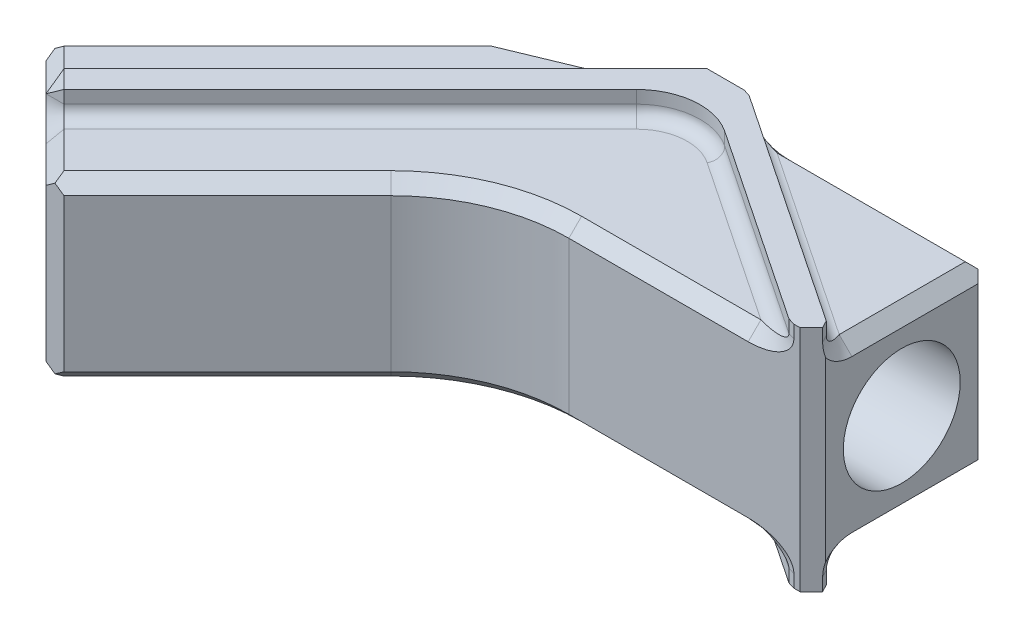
SolidWorks part; units mm, degrees
ref_plane "Front Plane" through (0, 0, 0) normal (0, 0, 1) x (1, 0, 0)
ref_plane "Top Plane" through (0, 0, 0) normal (0, 1, 0) x (1, 0, 0)
ref_plane "Right Plane" through (0, 0, 0) normal (1, 0, 0) x (0, 0, -1)
sketch "Sketch1" plane through (0, 0, 0) normal (0, 1, 0) x (1, 0, 0)
  line L0 (0, 0) -> (-9.8995, 9.8995)
  line L1 (0, 0) -> (25, 0)
  line L2 (0, 0) -> (0, 14)
  line L3 (0, 14) -> (25, 14)
  line L4 (25, 0) -> (25, 14)
  line L5 (-17.6777, -17.6777) -> (-27.5772, -7.7782)
  line L6 (0, 0) -> (-17.6777, -17.6777)
  line L7 (-9.8995, 9.8995) -> (-27.5772, -7.7782)
  line L8 (-9.8995, 9.8995) -> (0, 14)
  dimension "D1" = 25
  dimension "D2" = 14
  dimension "D3" = 25
  dimension "D4" = 14
  dimension "D5" = 14
extrude "Boss-Extrude1" add sketch "Sketch1" along normal blind 14 contours L0 L7 L5 L6 | L8 L0 L2 | L1 L4 L3 L2
sketch "Sketch2" plane through (25, 0, 0) normal (1, 0, 0) x (0, 0, -1)
  line L0 (0, 14) -> (14, 14) construction
  line L1 (0, 14) -> (0, 0) construction
  circle A0 centre (7, 7) radius 4.6
  dimension "D3" = 9.2
  dimension "D1" = 7
  dimension "D2" = 7
extrude "Cut-Extrude1" cut sketch "Sketch2" against normal blind 20
sketch "Sketch3" plane through (-17.6777, 0, 17.6777) normal (-0.7071, 0, 0.7071) x (0.7071, 0, 0.7071)
  line L0 (0, 14) -> (-14, 14) construction
  line L1 (-14, 14) -> (-14, 0) construction
  circle A0 centre (-7, 7) radius 4.1
  dimension "D1" = 8.2
  dimension "D2" = 7
  dimension "D3" = 7
extrude "Cut-Extrude2" cut sketch "Sketch3" against normal blind 20
sketch "Sketch4" plane through (0, 14, 0) normal (0, 1, 0) x (1, 0, 0)
  line L0 (-23.3345, -12.0208) -> (2.6863, 14)
  line L1 (-17.6777, -17.6777) -> (-27.5772, -7.7782) construction
  line L2 (-9.8995, 9.8995) -> (-27.5772, -7.7782) construction
  line L3 (-21.9203, -13.435) -> (5.5147, 14)
  line L4 (5.5147, 14) -> (2.6863, 14)
  line L5 (0, 14) -> (25, 14) construction
  line L6 (-23.3345, -12.0208) -> (-21.9203, -13.435)
  dimension "D1" = 6
extrude "Boss-Extrude2" add sketch "Sketch4" along normal blind 2
sketch "Sketch5" plane through (0, 0, 0) normal (0, -1, 0) x (-1, 0, 0)
  line L0 (21.9203, -13.435) -> (-5.5147, 14)
  line L1 (17.6777, -17.6777) -> (27.5772, -7.7782) construction
  line L2 (0, 14) -> (-25, 14) construction
  line L3 (0, 0) -> (17.6777, -17.6777) construction
  line L4 (23.3345, -12.0208) -> (-2.6863, 14)
  line L5 (21.9203, -13.435) -> (23.3345, -12.0208)
  line L6 (-2.6863, 14) -> (-5.5147, 14)
  dimension "D1" = 6
  dimension "D2" = 2
extrude "Boss-Extrude3" add sketch "Sketch5" along normal blind 2
sketch "Sketch6" plane through (0, 0, 0) normal (0, -1, 0) x (-1, 0, 0)
  line L0 (-4.1005, 14) -> (-25, 0) construction
  line L1 (-2.6863, 14) -> (-5.5147, 14) construction
  line L2 (-4.1005, 14) -> (-25, 0) construction
  line L3 (-3.544, 13.1692) -> (-24.4435, -0.8308)
  line L4 (-4.657, 14.8308) -> (-25.5565, 0.8308)
  line L5 (-25, 0) -> (-23.2032, 0)
  line L6 (0, 0) -> (-25, 0) construction
  line L7 (-25, 0) -> (-25, 1.2036)
  line L8 (-25, 0) -> (-25, 14) construction
  arc A0 (-3.544, 13.1692) -> (-4.657, 14.8308) centre (-4.1005, 14) ccw
  arc A1 (-25.5565, 0.8308) -> (-24.4435, -0.8308) centre (-25, 0) ccw
  point P5 (-14.5503, 7)
  dimension "D1" = 1
extrude "Boss-Extrude4" add sketch "Sketch6" along normal blind 2 contours L4 L3 M3 M4 M5 M2
sketch "Sketch7" plane through (0, 14, 0) normal (0, 1, 0) x (1, 0, 0)
  line L0 (4.1005, 14) -> (25, 0) construction
  line L1 (5.5147, 14) -> (2.6863, 14) construction
  line L2 (4.1005, 14) -> (25, 0) construction
  line L3 (4.657, 14.8308) -> (25.5565, 0.8308)
  line L4 (3.544, 13.1692) -> (24.4435, -0.8308)
  line L5 (25, 1.2036) -> (25, 0)
  line L6 (25, 0) -> (25, 14) construction
  line L7 (25, 0) -> (23.2032, 0)
  line L8 (0, 0) -> (25, 0) construction
  arc A0 (4.657, 14.8308) -> (3.544, 13.1692) centre (4.1005, 14) ccw
  arc A1 (24.4435, -0.8308) -> (25.5565, 0.8308) centre (25, 0) ccw
  point P5 (14.5503, 7)
  dimension "D1" = 1
extrude "Boss-Extrude5" add sketch "Sketch7" along normal blind 2 contours L4 L3 M6 M9 M10 M11
fillet "Fillet1" radius 5 2 edges at (4.2266, 15, -12.7119) (4.2266, -1, -12.7119)
fillet "Fillet2" radius 1 5 edges at (-10.2993, 14, 1.8141) (4.37, 14, -11.2476) (15.4487, 14, -7.6018) (-10.3241, 14, -0.9896) (15.4215, 14, -5.2127)
fillet "Fillet3" radius 1 5 edges at (15.4215, 0, -5.2127) (4.37, 0, -11.2476) (15.4487, 0, -7.6018) (-10.3241, 0, -0.9896) (-10.2993, 0, 1.8141)
sketch "Sketch8" plane through (0, 0, -14) normal (0, 0, -1) x (-1, 0, 0)
  line L0 (-5.8973, 16) -> (-5.8973, -2)
  line L1 (-2.6863, 16) -> (-2.6863, -2)
  line L2 (-5.8973, -2) -> (-2.6863, -2)
  line L3 (-5.8973, 16) -> (-2.6863, 16)
fillet "Fillet4" radius 14 1 edges at (0, 7, 0)
chamfer "Chamfer1" distance 1 angle 45 20 edges at (-10.8891, 0, 10.8891) (-10.8891, 14, 10.8891) (23.2032, -1.5, 0) (0.4414, 14, 1.0657) (0.4414, 0, 1.0657) (22.6769, -0.2929, 0) (13.6027, 0, 0) (23.2032, 15.5, 0) (22.6769, 14.2929, 0) (13.6027, 14, 0) (5.8973, 15.5, -14) (6.4236, 14.2929, -14) (16.3471, 14, -14) (5.8973, -1.5, -14) (6.4236, -0.2929, -14) (16.3471, 0, -14) (-18.7383, 0, -1.0607) (-18.7383, 14, -1.0607) (-4.9497, 0, -11.9497) (-4.9497, 14, -11.9497)
sketch "Sketch9" plane through (-3.5355, 0, 3.5355) normal (-0.7071, 0, 0.7071) x (0.7071, 0, 0.7071)
  circle A0 centre (-7, 7) radius 2
  dimension "D1" = 4
extrude "Cut-Extrude3" cut sketch "Sketch9" against normal blind 100
sketch "Sketch10" plane through (0, 0, -14) normal (0, 0, -1) x (-1, 0, 0)
  line L0 (-25, 13) -> (-25, 1) construction
  line L1 (-6.1499, 16) -> (-25, 16) construction
  line L2 (-6.1499, -2) -> (-25, -2) construction
  circle A0 centre (-15, 11) radius 1.5
  circle A1 centre (-15, 3) radius 1.5
  dimension "D3" = 3
  dimension "D4" = 3
  dimension "D1" = 10
  dimension "D2" = 10
  dimension "D5" = 5
  dimension "D6" = 5
extrude "Cut-Extrude4" cut sketch "Sketch10" against normal blind 2
chamfer "Chamfer2" distance 1 angle 45 24 edges at (-22.6274, 16, 12.7279) (-22.6274, -2, 12.7279) (-17.6777, 7, 17.6777) (-21.9203, -1.5, 13.435) (-21.7132, -0.2929, 13.6421) (-19.799, 0, 15.5563) (-21.9203, 15.5, 13.435) (-21.7132, 14.2929, 13.6421) (-19.799, 14, 15.5563) (-27.5772, 7, 7.7782) (-23.3345, -1.5, 12.0208) (-23.5416, -0.2929, 11.8137) (-25.4558, 0, 9.8995) (-23.3345, 15.5, 12.0208) (-23.5416, 14.2929, 11.8137) (-25.4558, 14, 9.8995) (25, 7, 0) (25, -1.5, -1.2036) (25, -0.2929, -1.5562) (25, 0, -7.7036) (25, 15.5, -1.2036) (25, 14.2929, -1.5562) (25, 14, -7.7036) (25, 7, -14)
